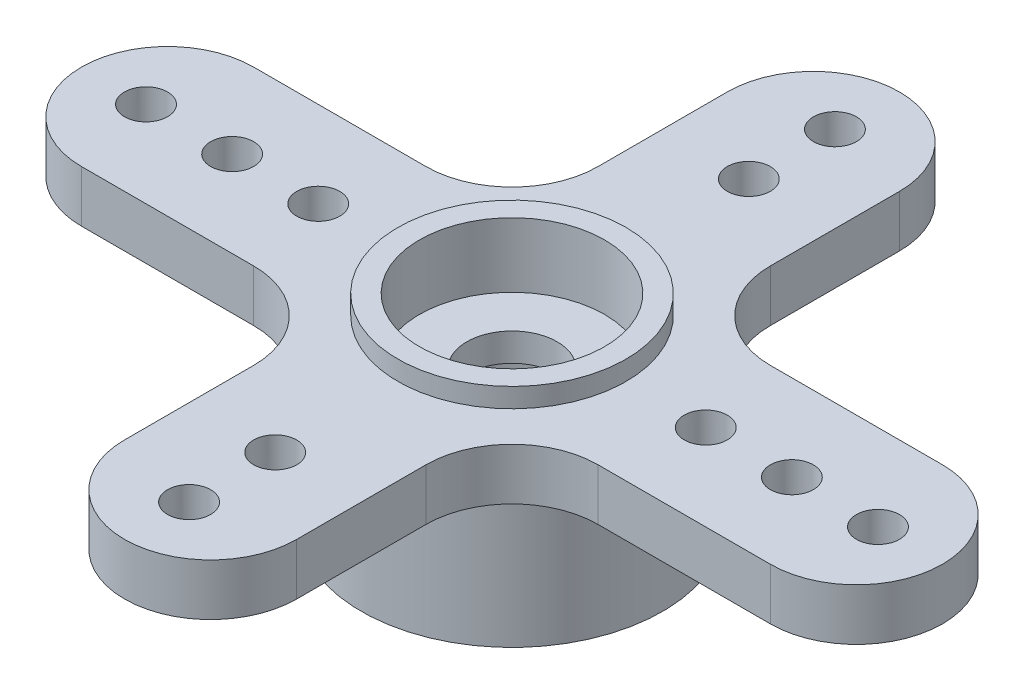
SolidWorks part; units mm, degrees
ref_plane "Front Plane" through (0, 0, 0) normal (0, 0, 1) x (1, 0, 0)
ref_plane "Top Plane" through (0, 0, 0) normal (0, 1, 0) x (1, 0, 0)
ref_plane "Right Plane" through (0, 0, 0) normal (1, 0, 0) x (0, 0, -1)
sketch "Sketch1" plane through (0, 0, 0) normal (0, 0, 1) x (1, 0, 0)
  line L0 (0, -19.458) -> (0, 42.1954) construction
  line L1 (1.05, 0) -> (2.25, 0)
  line L2 (2.25, 0) -> (2.25, -2.5)
  line L3 (2.25, -2.5) -> (3.5, -2.5)
  line L4 (3.5, -2.5) -> (3.5, 0.5)
  line L5 (3.5, 0.5) -> (25, 0.5)
  line L6 (25, 0.5) -> (25, 1.7)
  line L7 (25, 1.7) -> (2.65, 1.7)
  line L8 (2.65, 1.7) -> (2.65, 2.15)
  line L9 (2.65, 2.15) -> (2.15, 2.15)
  line L10 (2.15, 2.15) -> (2.15, 0.65)
  line L11 (2.15, 0.65) -> (1.05, 0.65)
  line L12 (1.05, 0.65) -> (1.05, 0)
  dimension "D1" = 7
  dimension "D2" = 1.2
  dimension "D3" = 4.5
  dimension "D4" = 2.1
  dimension "D5" = 5.3
  dimension "D6" = 4.3
  dimension "D7" = 1.5
  dimension "D8" = 0.45
  dimension "D9" = 2.5
  dimension "D10" = 50
  dimension "D11" = 4.65
  dimension "D12" = 3
revolve "Revolve1" add sketch "Sketch1" angle 360 about L0
hole_wizard "Ø1.0 (1) Diameter Hole1" positions "Sketch3" profile "Sketch2" hole size "Ø1.0" standard "ISO"
sketch "Sketch3" plane through (0, 1.7, 0) normal (0, 1, 0) x (-1, 0, 0)
  point P0 (8.5, 0)
  point P1 (4.5, 0)
  point P3 (6.5, 0)
  point P5 (12.5, 0)
  point P7 (15, 0)
  dimension "D1" = 4.5
  dimension "D2" = 6.5
  dimension "D3" = 8.5
  dimension "D4" = 12.5
  dimension "D5" = 15
sketch "Sketch2" plane through (-8.5, 1.7, 0) normal (1, 0, 0) x (0, 0, 1)
  line L0 (0, 0) -> (0, 387.7304)
  line L1 (0, 387.7304) -> (0.5, 387.43)
  line L2 (0.5, 387.43) -> (0.5, 0)
  line L5 (0.5, 0) -> (0, 0)
  line L10 (0, 387.7304) -> (-0.5, 387.43) construction
  line L11 (0, -6.35) -> (0, 107.95) construction
  dimension "Hole Dia." = 1
  dimension "Hole Depth" = 387.43
  dimension "Drill Angle" = 118
pattern_circular "CirPattern1" count 2 over 360 about axis through (0, 0, 0) along (0, 1, 0) of "Ø1.0 (1) Diameter Hole1"
sketch "Sketch4" plane through (0, 1.7, 0) normal (0, 1, 0) x (-1, 0, 0)
  line L0 (0.42, 3.4747) -> (12.74, 1.9855)
  line L1 (12.74, -1.9855) -> (0.42, -3.4747)
  line L2 (0, 6.4146) -> (0, 9.2753) construction
  line L3 (-12.74, -1.9855) -> (-0.42, -3.4747)
  line L4 (-0.42, 3.4747) -> (-12.74, 1.9855)
  arc A0 (12.74, -1.9855) -> (12.74, 1.9855) centre (12.5, 0) ccw
  arc A1 (0.42, 3.4747) -> (-0.42, 3.4747) centre (0, 0) ccw
  arc A2 (-12.74, -1.9855) -> (-12.74, 1.9855) centre (-12.5, 0) cw
  arc A3 (-0.42, -3.4747) -> (0.42, -3.4747) centre (0, 0) ccw
  dimension "D1" = 4
  dimension "D3" = 7
  dimension "D2" = 14.5
extrude "Cut-Extrude1" [suppressed] cut sketch "Sketch4" against normal through all and the other way through all flip side to cut
sketch "Sketch5" [suppressed] plane through (0, 1.7, 0) normal (0, 1, 0) x (1, 0, 0)
  circle A0 centre (0, 0) radius 10
  dimension "D1" = 20
extrude "Cut-Extrude2" [suppressed] cut sketch "Sketch5" against normal through all and the other way through all flip side to cut
sketch "Sketch6" plane through (0, 1.7, 0) normal (0, 1, 0) x (1, 0, 0)
  line L0 (12, 2) -> (5, 2)
  line L1 (12, -2) -> (5, -2)
  line L2 (-2, -10.5) -> (-2, -5)
  line L3 (2, -10.5) -> (2, -5)
  line L4 (-12, 2) -> (-5, 2)
  line L5 (-12, -2) -> (-5, -2)
  line L6 (2, 10.5) -> (2, 5)
  line L7 (-2, 10.5) -> (-2, 5)
  line L8 (0, -3.6766) -> (0, -3.0426) construction
  line L9 (-4.0579, 0) -> (-3.3662, 0) construction
  arc A0 (12, -2) -> (12, 2) centre (12, 0) ccw
  arc A1 (-2, -10.5) -> (2, -10.5) centre (0, -10.5) ccw
  arc A2 (-12, 2) -> (-12, -2) centre (-12, 0) ccw
  arc A3 (2, 10.5) -> (-2, 10.5) centre (0, 10.5) ccw
  arc A4 (5, -2) -> (2, -5) centre (5, -5) ccw
  arc A5 (-2, -5) -> (-5, -2) centre (-5, -5) ccw
  arc A6 (-5, 2) -> (-2, 5) centre (-5, 5) ccw
  arc A7 (2, 5) -> (5, 2) centre (5, 5) ccw
  dimension "D1" = 4
  dimension "D2" = 12
  dimension "D4" = 3
  dimension "D5" = 8.1421
  dimension "D3" = 25
extrude "Cut-Extrude4" [suppressed] cut sketch "Sketch6" against normal through all and the other way through all flip side to cut
hole_wizard "Ø1.0 (1) Diameter Hole2" positions "Sketch8" profile "Sketch7" hole size "Ø1.0" standard "ISO"
sketch "Sketch8" plane through (0, 1.7, 0) normal (0, 1, 0) x (-1, 0, 0)
  point P0 (0, -5.5)
  point P1 (0, -7.5)
  point P3 (0, -11)
  dimension "D1" = 5.5
  dimension "D2" = 7.5
  dimension "D3" = 11
sketch "Sketch7" plane through (0, 1.7, -5.5) normal (1, 0, 0) x (0, 0, 1)
  line L0 (0, 0) -> (0, 387.7304)
  line L1 (0, 387.7304) -> (0.5, 387.43)
  line L2 (0.5, 387.43) -> (0.5, 0)
  line L5 (0.5, 0) -> (0, 0)
  line L10 (0, 387.7304) -> (-0.5, 387.43) construction
  line L11 (0, -6.35) -> (0, 107.95) construction
  dimension "Hole Dia." = 1
  dimension "Hole Depth" = 387.43
  dimension "Drill Angle" = 118
pattern_circular "CirPattern2" count 2 over 360 about axis through (0, 0, 0) along (0, 1, 0) of "Ø1.0 (1) Diameter Hole2"
sketch "Sketch9" plane through (0, 1.7, 0) normal (0, 1, 0) x (1, 0, 0)
  line L0 (8, 2) -> (4, 2)
  line L1 (8, -2) -> (4, -2)
  line L2 (-2, -7) -> (-2, -4)
  line L3 (2, -7) -> (2, -4)
  line L4 (-8, 2) -> (-4, 2)
  line L5 (-8, -2) -> (-4, -2)
  line L6 (2, 7) -> (2, 4)
  line L7 (-2, 7) -> (-2, 4)
  line L8 (0, -3.6766) -> (0, -3.0426) construction
  line L9 (-2.8102, 0) -> (-2.1185, 0) construction
  arc A0 (8, -2) -> (8, 2) centre (8, 0) ccw
  arc A1 (-2, -7) -> (2, -7) centre (0, -7) ccw
  arc A2 (-8, 2) -> (-8, -2) centre (-8, 0) ccw
  arc A3 (2, 7) -> (-2, 7) centre (0, 7) ccw
  arc A4 (4, -2) -> (2, -4) centre (4, -4) ccw
  arc A5 (-2, -4) -> (-4, -2) centre (-4, -4) ccw
  arc A6 (-4, 2) -> (-2, 4) centre (-4, 4) ccw
  arc A7 (2, 4) -> (4, 2) centre (4, 4) ccw
  dimension "D1" = 4
  dimension "D2" = 20
  dimension "D4" = 2
  dimension "D5" = 7.3137
  dimension "D3" = 18
extrude "Cut-Extrude5" cut sketch "Sketch9" against normal through all and the other way through all flip side to cut
